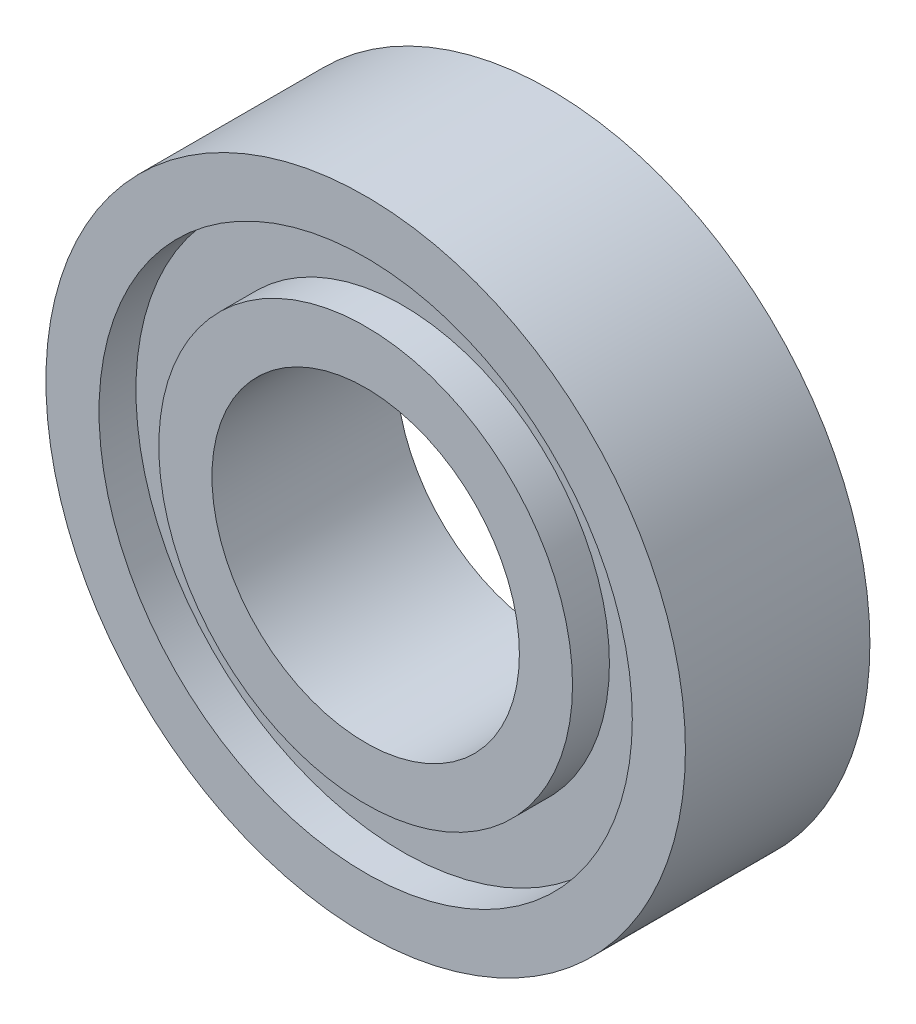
SolidWorks part; units mm, degrees
ref_plane "Front Plane" through (0, 0, 0) normal (0, 0, 1) x (1, 0, 0)
ref_plane "Top Plane" through (0, 0, 0) normal (0, 1, 0) x (1, 0, 0)
ref_plane "Right Plane" through (0, 0, 0) normal (1, 0, 0) x (0, 0, -1)
sketch "Skizze1" plane through (0, 0, 0) normal (0, 0, 1) x (1, 0, 0)
  circle A0 centre (0, 0) radius 26
  circle A1 centre (0, 0) radius 21.68
  dimension "D1" = 52
extrude "Aufsatz-Linear austragen1" add sketch "Skizze1" along normal mid plane 15
sketch "Skizze2" plane through (0, 0, 0) normal (0, 0, 1) x (1, 0, 0)
  circle A0 centre (0, 0) radius 16.82
  circle A1 centre (0, 0) radius 12.5
  dimension "D1" = 25
extrude "Aufsatz-Linear austragen2" add sketch "Skizze2" along normal mid plane 15
sketch "Skizze3" plane through (0, 0, 0) normal (0, 0, 1) x (1, 0, 0)
  circle A0 centre (0, 0) radius 21.68
  circle A1 centre (0, 0) radius 16.57
extrude "Aufsatz-Linear austragen3" add sketch "Skizze3" along normal mid plane 9
